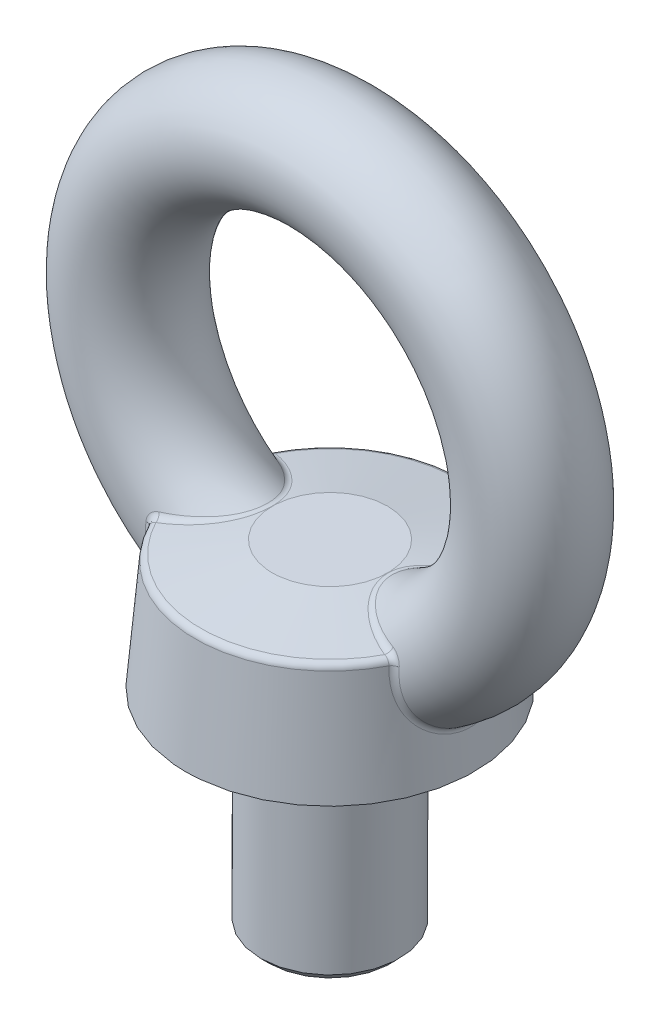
SolidWorks part; units mm, degrees
ref_plane "Front Plane" through (0, 0, 0) normal (0, 0, 1) x (1, 0, 0)
ref_plane "Top Plane" through (0, 0, 0) normal (0, 1, 0) x (1, 0, 0)
ref_plane "Right Plane" through (0, 0, 0) normal (1, 0, 0) x (0, 0, -1)
sketch "Sketch1" plane through (0, 0, 0) normal (0, 0, 1) x (1, 0, 0)
  ellipse E0 centre (0, 45) end of major axis (0, 0) minor radius 45
  dimension "D1" = 90
  dimension "D2" = 90
sketch "Sketch2" plane through (0, 0, 0) normal (1, 0, 0) x (0, 0, -1)
  line L3 (0, 90) -> (0, 0) construction
  circle A0 centre (0, 10) radius 10
  point P5 (0, 0)
sweep "Sweep1" add profiles "Sketch2" path "Sketch1"
sketch "Sketch3" plane through (0, 0, 0) normal (1, 0, 0) x (0, 0, -1)
  line L0 (0, 0) -> (-25, 0)
  line L1 (-25, 0) -> (-23.2502, 20)
  line L2 (-23.2502, 20) -> (-10, 22.3364)
  line L3 (-10, 22.3364) -> (0, 22.3364)
  line L4 (0, 22.3364) -> (0, 0)
revolve "Revolve1" add sketch "Sketch3" angle 360 about L4
fillet "Fillet1" radius 1.2 6 edges at (10.4718, 22.245, 0.9878) (24.3488, 7.2146, 0.9881) (-10.4718, 22.245, -0.9878) (-24.3488, 7.2146, -0.9881) (0, 20, -23.2502) (0, 20, 23.2502)
sketch "Sketch4" plane through (0, 0, 0) normal (0, -1, 0) x (1, 0, 0)
  circle A0 centre (0, 0) radius 12
  dimension "D1" = 24
extrude "Extrude1" add sketch "Sketch4" along normal blind 36
chamfer "Chamfer1" distance 1.5 angle 45 1 edges at (0, -36, -12)
sketch "Sketch5" plane through (0, 0, 0) normal (1, 0, 0) x (0, 0, -1)
  line L0 (-12, 0) -> (-12, -4.0981)
  line L1 (-12, 0) -> (-12, -34.5) construction
  line L2 (-10.5, -1.5) -> (-12, -4.0981)
  line L3 (-10.5, -1.5) -> (-10.5, -0.75)
  line L4 (-11.25, 0) -> (-12, 0)
  line L5 (-11.25, -0.75) -> (-10.5, -0.75) construction
  arc A1 (-10.5, -0.75) -> (-11.25, 0) centre (-11.25, -0.75) ccw
  point P0 (-10.5, -36)
  dimension "D1" = 30
revolve "Cut-Revolve1" cut sketch "Sketch5" angle 360 about axis through (0, -36, 0) along (0, 1, 0)
equation "\"D4@Sketch3\" = \"D1@Sketch2\""
equation "\"D5@Sketch3\" = \"D1@Sketch2\"/2"
